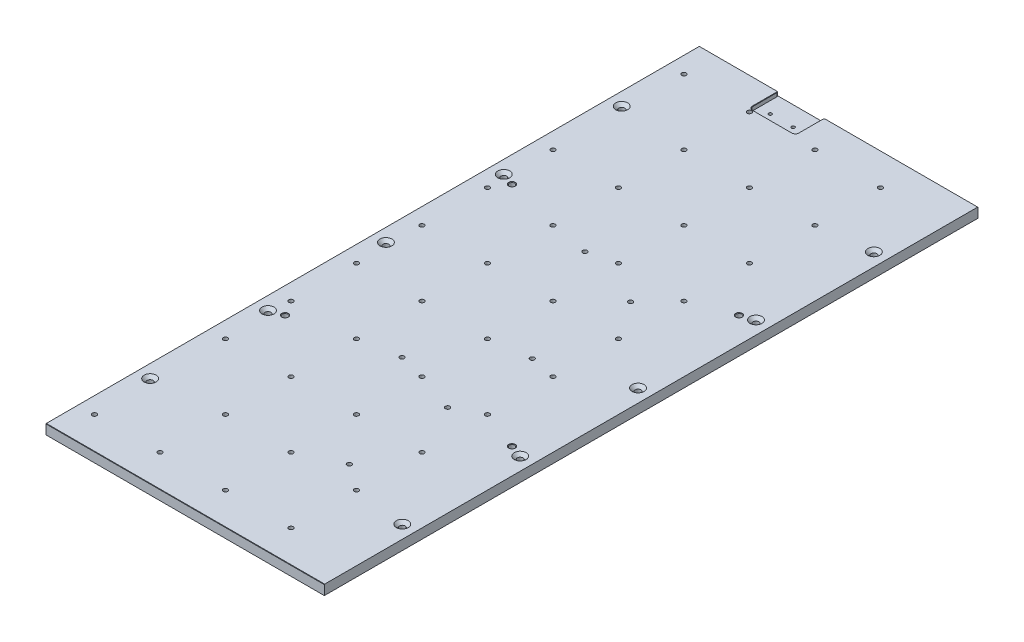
SolidWorks part; units mm, degrees
ref_plane "Ebene vorne" through (0, 0, 0) normal (0, 0, 1) x (1, 0, 0)
ref_plane "Ebene oben" through (0, 0, 0) normal (0, 1, 0) x (1, 0, 0)
ref_plane "Ebene rechts" through (0, 0, 0) normal (1, 0, 0) x (0, 0, -1)
sketch "Skizze1" plane through (0, 0, 0) normal (0, 1, 0) x (1, 0, 0)
  line L0 (-688, 499) -> (-748, 439)
  line L1 (-688, -499) -> (688, -499)
  line L2 (-688, -499) -> (-688, 499) construction
  line L3 (-688, 499) -> (688, 499)
  line L4 (688, -499) -> (688, 499) construction
  line L5 (-688, -499) -> (688, 499) construction
  line L6 (-688, 499) -> (688, -499) construction
  line L7 (-748, 439) -> (-748, -439)
  line L8 (-688, -499) -> (-748, -439)
  line L10 (688, -499) -> (748, -439)
  line L11 (748, -439) -> (748, 439)
  line L12 (748, 439) -> (688, 499)
  line L13 (-748, 0) -> (0, 0) construction
  point P0 (0, 0)
  dimension "D1" = 1496
  dimension "D2" = 998
  dimension "D3" = 60
  dimension "D4" = 45
extrude "Aufsatz-Linear austragen1" add sketch "Skizze1" along normal blind 15
hole_wizard "HORST900 Mitte Vorne_M8 Gewindebohrung1" positions "Skizze4" profile "Skizze5" tap size "M8" standard "DIN"
sketch "Skizze4" plane through (0, 15, 0) normal (0, 1, 0) x (1, 0, 0)
  line L0 (-688, -499) -> (688, -499) construction
  line L1 (0, -181.5) -> (-197.5, -181.5) construction
  line L2 (-197.5, -181.5) -> (0, 16) construction
  line L3 (0, 16) -> (197.5, -181.5) construction
  line L4 (197.5, -181.5) -> (0, -379) construction
  line L5 (0, -379) -> (-197.5, -181.5) construction
  line L7 (-139.6536, -321.1536) -> (139.6536, -41.8464) construction
  line L8 (-139.6536, -41.8464) -> (139.6536, -321.1536) construction
  circle A0 centre (0, -181.5) radius 197.5 construction
  point P21 (-139.6536, -321.1536)
  point P22 (139.6536, -41.8464)
  point P23 (-139.6536, -41.8464)
  point P24 (139.6536, -321.1536)
  dimension "D1" = 395
  dimension "D2" = 120
sketch "Skizze5" plane through (139.6536, 15, 321.1536) normal (1, 0, 0) x (0, 0, 1)
  line L0 (0, 0) -> (0, 15)
  line L1 (0, 15) -> (3.4, 15)
  line L2 (3.4, 15) -> (3.4, 0)
  line L5 (3.4, 0) -> (0, 0)
  line L11 (0, -6.35) -> (0, 107.95) construction
  dimension "Bohrerdurchmesser" = 6.8
  dimension "Bohrungstiefe" = 15
hole_wizard "HORST900_Links_Rechts_M8 Gewindebohrung1" positions "Skizze6" profile "Skizze7" tap size "M8" standard "DIN"
sketch "Skizze6" plane through (0, 15, 0) normal (0, 1, 0) x (1, 0, 0)
  line L1 (240.8464, -139.6536) -> (520.1536, -139.6536) construction
  line L2 (240.8464, -139.6536) -> (240.8464, 139.6536) construction
  line L3 (240.8464, 139.6536) -> (520.1536, 139.6536) construction
  line L4 (520.1536, -139.6536) -> (520.1536, 139.6536) construction
  line L5 (240.8464, -139.6536) -> (520.1536, 139.6536) construction
  line L6 (240.8464, 139.6536) -> (520.1536, -139.6536) construction
  line L7 (748, -439) -> (748, 439) construction
  circle A0 centre (380.5, 0) radius 197.5 construction
  point P5 (520.1536, 139.6536)
  point P8 (240.8464, -139.6536)
  point P9 (240.8464, 139.6536)
  point P10 (520.1536, -139.6536)
  dimension "D1" = 395
  dimension "D2" = 170
sketch "Skizze7" plane through (520.1536, 15, 139.6536) normal (1, 0, 0) x (0, 0, 1)
  line L0 (0, 0) -> (0, 15)
  line L1 (0, 15) -> (3.4, 15)
  line L2 (3.4, 15) -> (3.4, 0)
  line L5 (3.4, 0) -> (0, 0)
  line L11 (0, -6.35) -> (0, 107.95) construction
  dimension "Bohrerdurchmesser" = 6.8
  dimension "Bohrungstiefe" = 15
pattern_linear "HORST900_MitteM8 Gewindebohrung1" count 2 spacing 150 along (0, 0, -1) of "HORST900 Mitte Vorne_M8 Gewindebohrung1"
hole_wizard "Raster_M8 Gewindebohrung3" positions "Skizze9" profile "Skizze10" tap size "M8" standard "DIN"
sketch "Skizze9" plane through (0, 15, 0) normal (0, 1, 0) x (1, 0, 0)
  point P0 (-700, -450)
  dimension "D1" = 700
  dimension "D2" = 450
sketch "Skizze10" plane through (-700, 15, 450) normal (1, 0, 0) x (0, 0, 1)
  line L0 (0, 0) -> (0, 15)
  line L1 (0, 15) -> (3.4, 15)
  line L2 (3.4, 15) -> (3.4, 0)
  line L5 (3.4, 0) -> (0, 0)
  line L11 (0, -6.35) -> (0, 107.95) construction
  dimension "Bohrerdurchmesser" = 6.8
  dimension "Bohrungstiefe" = 15
hole_wizard "Formsenkung für M8 Senkschraube mit Innensechskant1" positions "Skizze2" profile "Skizze3" countersink size "M8" standard "DIN"
sketch "Skizze2" plane through (0, 15, 0) normal (0, 1, 0) x (1, 0, 0)
  line L1 (445, -360) -> (-445, -360)
  line L2 (445, -360) -> (445, 360)
  line L3 (445, 360) -> (-445, 360)
  line L4 (-445, -360) -> (-445, 360)
  line L5 (445, -360) -> (-445, 360) construction
  line L6 (445, 360) -> (-445, -360) construction
  line L7 (0, 0) -> (-610.081, 0) construction
  line L8 (-555, 210) -> (-555, -210) construction
  line L13 (0, 0) -> (0, -385.3386) construction
  line L18 (555, 210) -> (555, -210) construction
  line L19 (-20, 360) -> (-20, -360)
  line L21 (20, 360) -> (20, -360)
  line L22 (-555, 250) -> (-555, 210) construction
  line L24 (-555, -210) -> (-555, -250) construction
  line L26 (555, -210) -> (555, -250) construction
  line L28 (555, 210) -> (555, 250) construction
  line L29 (445, 0) -> (405, 0) construction
  point P2 (-445, 360)
  point P5 (445, -360)
  point P6 (445, 360)
  point P7 (-445, -360)
  point P98 (-555, 210)
  point P100 (-555, -210)
  point P123 (555, 210)
  point P125 (555, -210)
  point P139 (-20, 360)
  point P142 (20, 360)
  point P145 (-20, -360)
  point P148 (20, -360)
  point P150 (-20, 0)
  point P152 (20, 0)
  point P174 (-555, 250)
  point P177 (-555, -250)
  point P180 (555, -250)
  point P183 (555, 250)
  point P184 (-405, 360)
  point P186 (405, 360)
  point P188 (405, -360)
  point P190 (-405, -360)
  point P191 (-445, 0)
  point P193 (-405, 0)
  point P195 (445, 0)
  point P197 (405, 0)
  dimension "D1" = 890
  dimension "D2" = 720
  dimension "D3" = 40
  dimension "D4" = 1110
  dimension "D5" = 500
  dimension "D6" = 40
  dimension "D7" = 40
  dimension "D8" = 40
  dimension "D9" = 40
  dimension "D10" = 40
  dimension "D11" = 40
  dimension "D12" = 40
sketch "Skizze3" plane through (-445, 15, -360) normal (1, 0, 0) x (0, 0, 1)
  line L0 (0, 0) -> (0, 15)
  line L1 (0, 15) -> (4.5, 15)
  line L2 (4.5, 15) -> (4.5, 4.625)
  line L3 (4.5, 4.625) -> (9.125, 0)
  line L5 (9.125, 0) -> (0, 0)
  line L6 (-4.5, 4.625) -> (-9.125, 0) construction
  line L11 (0, -6.35) -> (0, 107.95) construction
  dimension "Bohrerdurchmesser" = 9
  dimension "Bohrungstiefe" = 15
  dimension "Senkdurchmesser (Oben)" = 18.25
  dimension "Senkwinkel (Oben)" = 90
sketch "Skizze8" plane through (0, 15, 0) normal (0, 1, 0) x (1, 0, 0)
  line L1 (100, 300) -> (200, 300)
  line L2 (95, 305) -> (95, 337)
  line L3 (100, 342) -> (200, 342)
  line L4 (205, 305) -> (205, 337)
  line L5 (95, 300) -> (205, 342) construction
  line L6 (95, 342) -> (205, 300) construction
  arc A0 (95, 305) -> (100, 300) centre (100, 305) ccw
  arc A1 (200, 300) -> (205, 305) centre (200, 305) ccw
  arc A2 (205, 337) -> (200, 342) centre (200, 337) ccw
  arc A3 (100, 342) -> (95, 337) centre (100, 337) ccw
  point P0 (150, 321)
  dimension "D5" = 5
  dimension "D1" = 150
  dimension "D2" = 110
  dimension "D3" = 42
  dimension "D4" = 321
extrude "Schnitt-Linear austragen1" cut sketch "Skizze8" against normal through all
hole_wizard "M5 Gewindebohrung1" positions "Skizze17" profile "Skizze18" tap size "M5" standard "DIN"
sketch "Skizze17" plane through (0, 15, 0) normal (0, 1, 0) x (1, 0, 0)
  line L0 (150, 342) -> (150, 300) construction
  line L1 (200, 342) -> (100, 342) construction
  line L2 (100, 300) -> (200, 300) construction
  line L3 (95, 321) -> (150, 321) construction
  line L4 (95, 337) -> (95, 305) construction
  line L5 (150, 321) -> (205, 321) construction
  line L6 (205, 305) -> (205, 337) construction
  point P17 (85, 337)
  point P19 (85, 305)
  point P21 (215, 305)
  point P23 (215, 337)
  dimension "D1" = 32
  dimension "D2" = 130
sketch "Skizze18" plane through (215, 15, -337) normal (1, 0, 0) x (0, 0, 1)
  line L0 (0, 0) -> (0, 13.2618)
  line L1 (0, 13.2618) -> (2.1, 12)
  line L2 (2.1, 12) -> (2.1, 0)
  line L5 (2.1, 0) -> (0, 0)
  line L10 (0, 13.2618) -> (-2.1, 12) construction
  line L11 (0, -6.35) -> (0, 107.95) construction
  dimension "Bohrerdurchmesser" = 4.2
  dimension "Bohrungstiefe" = 12
  dimension "Spitzenwinkel" = 118
sketch "Skizze11" plane through (0, 15, 0) normal (0, 1, 0) x (1, 0, 0)
  line L0 (0, 0) -> (0, 417.1845) construction
  line L1 (688, 499) -> (-688, 499) construction
  line L2 (-270, 455) -> (-270, 499) construction
  line L3 (-305.1, 499) -> (-234.9, 499)
  line L4 (-305.1, 499) -> (-305.1, 460)
  line L5 (-300.1, 455) -> (-239.9, 455)
  line L6 (-234.9, 499) -> (-234.9, 460)
  line L7 (234.9, 499) -> (234.9, 460)
  line L8 (300.1, 455) -> (239.9, 455)
  line L9 (305.1, 499) -> (305.1, 460)
  line L10 (305.1, 499) -> (234.9, 499)
  arc A0 (-234.9, 460) -> (-239.9, 455) centre (-239.9, 460) cw
  arc A1 (-300.1, 455) -> (-305.1, 460) centre (-300.1, 460) cw
  arc A2 (300.1, 455) -> (305.1, 460) centre (300.1, 460) ccw
  arc A3 (234.9, 460) -> (239.9, 455) centre (239.9, 460) ccw
  point P12 (-234.9, 455)
  point P15 (-305.1, 455)
  point P25 (305.1, 455)
  point P26 (234.9, 455)
  dimension "D3" = 5
  dimension "D1" = 44
  dimension "D2" = 70.2
  dimension "D4" = 270
extrude "Schnitt-Linear austragen2" cut sketch "Skizze11" against normal blind 6
fillet "Verrundung2" radius 2 4 edges at (-234.9, 12, -499) (-305.1, 12, -499) (305.1, 12, -499) (234.9, 12, -499)
hole_wizard "M6 Gewindebohrung1" positions "Skizze12" profile "Skizze13" tap size "M6" standard "DIN"
sketch "Skizze12" plane through (0, 9, 0) normal (0, 1, 0) x (1, 0, 0)
  line L0 (-270, 95.0617) -> (-270, 469.2) construction
  line L1 (-270, 469.2) -> (-287.5, 469.2) construction
  line L3 (-270, 469.2) -> (-252.5, 469.2) construction
  line L6 (-300.1, 455) -> (-239.9, 455) construction
  line L7 (-270, 469.2) -> (-270, 499) construction
  line L8 (-232.9, 499) -> (-307.1, 499) construction
  point P0 (-287.5, 469.2)
  point P4 (-252.5, 469.2)
  dimension "D1" = 35
  dimension "D2" = 14.2
sketch "Skizze13" plane through (-287.5, 9, -469.2) normal (1, 0, 0) x (0, 0, 1)
  line L0 (0, 0) -> (0, 9)
  line L1 (0, 9) -> (2.5, 9)
  line L2 (2.5, 9) -> (2.5, 0)
  line L5 (2.5, 0) -> (0, 0)
  line L11 (0, -6.35) -> (0, 107.95) construction
  dimension "Bohrerdurchmesser" = 5
  dimension "Bohrungstiefe" = 9
mirror "Spiegeln3" about plane through (0, 0, 0) normal (1, 0, 0) of "HORST900_Links_Rechts_M8 Gewindebohrung1"
mirror "Spiegeln2" about plane through (0, 0, 0) normal (1, 0, 0) of "M6 Gewindebohrung1"
pattern_linear "Raster_M8 Gewindebohrung4" count 15 spacing 100 along (1, 0, 0) count 10 spacing 100 along (0, 0, -1) of "Raster_M8 Gewindebohrung3"
hole_wizard "Ø5.0mm Stiftloch1" positions "Skizze14" profile "Skizze15" hole size "Ø5.0" standard "DIN"
sketch "Skizze14" plane through (0, 15, 0) normal (0, 1, 0) x (1, 0, 0)
  line L1 (-500, -225) -> (500, -225)
  line L2 (-500, -225) -> (-500, 225)
  line L3 (-500, 225) -> (500, 225)
  line L4 (500, -225) -> (500, 225)
  line L5 (-500, -225) -> (500, 225) construction
  line L6 (-500, 225) -> (500, -225) construction
  point P2 (500, 225)
  point P5 (-500, -225)
  point P6 (-500, 225)
  point P7 (500, -225)
  dimension "D1" = 1000
  dimension "D2" = 450
sketch "Skizze15" plane through (500, 15, -225) normal (1, 0, 0) x (0, 0, 1)
  line L0 (0, 0) -> (0, 9.5022)
  line L1 (0, 9.5022) -> (2.5, 8)
  line L2 (2.5, 8) -> (2.5, 0)
  line L5 (2.5, 0) -> (0, 0)
  line L10 (0, 9.5022) -> (-2.5, 8) construction
  line L11 (0, -6.35) -> (0, 107.95) construction
  dimension "Bohrerdurchmesser" = 5
  dimension "Bohrungstiefe" = 8
  dimension "Spitzenwinkel" = 118
sketch "Skizze19" plane through (0, 15, 0) normal (0, 1, 0) x (1, 0, 0)
  line L0 (-748, -335.3333) -> (-584.3333, -499)
  line L1 (-748, 439) -> (-748, -439) construction
  line L2 (-688, -499) -> (688, -499) construction
  line L3 (-700, -450) -> (-666.6667, -416.6667) construction
  line L4 (-666.6667, -416.6667) -> (-633.3333, -383.3333) construction
  line L5 (-633.3333, -383.3333) -> (-600, -350) construction
  line L7 (-748, -335.3333) -> (-748, -499)
  line L8 (-748, -499) -> (-584.3333, -499)
  line L9 (0, 0) -> (-867.3636, 0) construction
  line L10 (0, 0) -> (0, 198.8508) construction
  line L11 (748, 335.3333) -> (584.3333, 499)
  line L12 (748, 335.3333) -> (748, 499)
  line L13 (748, 499) -> (584.3333, 499)
  line L14 (748, -499) -> (584.3333, -499)
  line L15 (-748, 499) -> (-584.3333, 499)
  line L16 (-748, 335.3333) -> (-748, 499)
  line L17 (-748, 335.3333) -> (-584.3333, 499)
  line L18 (748, -335.3333) -> (748, -499)
  line L19 (748, -335.3333) -> (584.3333, -499)
extrude "Schnitt-Linear austragen4" cut sketch "Skizze19" against normal through all
fillet "Verrundung1" radius 10 8 edges at (-584.3333, 7.5, 499) (584.3333, 7.5, 499) (748, 7.5, 335.3333) (748, 7.5, -335.3333) (584.3333, 7.5, -499) (-584.3333, 7.5, -499) (-748, 7.5, -335.3333) (-748, 7.5, 335.3333)
chamfer "Fase1" distance 0.5 angle 45 40 edges at (0, 15, -499) (-234.3142, 15, -498.4142) (234.3142, 15, -498.4142) (-234.9, 15, -478.5) (234.9, 15, -478.5) (-236.3645, 15, -456.4645) (236.3645, 15, -456.4645) (-270, 15, -455) (270, 15, -455) (-303.6355, 15, -456.4645) (303.6355, 15, -456.4645) (-305.1, 15, -478.5) (305.1, 15, -478.5) (-305.6858, 15, -498.4142) (305.6858, 15, -498.4142) (-443.6456, 15, -499) (443.6456, 15, -499) (-748, 15, 0) (748, 15, 0) (0, 15, 499) (150, 15, -300) (203.5355, 15, -301.4645) (96.4645, 15, -301.4645) (205, 15, -321) (95, 15, -321) (203.5355, 15, -340.5355) (96.4645, 15, -340.5355) (150, 15, -342) (-666.1667, 15, 417.1667) (-584.018, 15, 498.2388) (-584.018, 15, -498.2388) (584.018, 15, -498.2388) (-666.1667, 15, -417.1667) (666.1667, 15, -417.1667) (-747.2388, 15, -335.018) (747.2388, 15, -335.018) (-747.2388, 15, 335.018) (747.2388, 15, 335.018) (666.1667, 15, 417.1667) (584.018, 15, 498.2388)
ref_plane "Ebene1" through (425, 0, 0) normal (1, 0, 0) x (0, 0, -1)
ref_plane "Ebene2" through (-425, 0, 0) normal (1, 0, 0) x (0, 0, -1)
split "Abspalten1" [suppressed] bodies to split 128
split "Abspalten2" trim tools "Ebene1", "Ebene2", "Ebene rechts" bodies to split 128 resulting bodies 135
split "Abspalten3" [suppressed] bodies to split 138
hole_wizard "HORST1400 M10 Gewindebohrung1" positions "Skizze20" profile "Skizze21" tap size "M10" standard "DIN"
sketch "Skizze20" plane through (0, 15, 0) normal (0, 1, 0) x (1, 0, 0)
  line L1 (-385.7412, 173.2412) -> (-39.2588, 173.2412) construction
  line L2 (-385.7412, 173.2412) -> (-385.7412, -173.2412) construction
  line L3 (-385.7412, -173.2412) -> (-39.2588, -173.2412) construction
  line L4 (-39.2588, 173.2412) -> (-39.2588, -173.2412) construction
  line L6 (0, -498.5) -> (0, 498.5) construction
  line L7 (-212.5, 0) -> (-110.9328, 0) construction
  circle A0 centre (-212.5, 0) radius 245 construction
  point P0 (-39.2588, -173.2412)
  point P7 (-385.7412, 173.2412)
  point P137 (-385.7412, -173.2412)
  point P138 (-39.2588, 173.2412)
  dimension "D1" = 490
  dimension "D2" = 212.5
sketch "Skizze21" plane through (-39.2588, 15, 173.2412) normal (1, 0, 0) x (0, 0, 1)
  line L0 (0, 0) -> (0, 30.0537)
  line L1 (0, 30.0537) -> (4.25, 27.5)
  line L2 (4.25, 27.5) -> (4.25, 0.775)
  line L3 (4.25, 0.775) -> (5.025, 0)
  line L5 (5.025, 0) -> (0, 0)
  line L6 (-4.25, 0.775) -> (-5.025, 0) construction
  line L10 (0, 30.0537) -> (-4.25, 27.5) construction
  line L11 (0, -6.35) -> (0, 107.95) construction
  dimension "Bohrerdurchmesser" = 8.5
  dimension "Bohrungstiefe" = 27.5
  dimension "Senkdurchmesser (Oben)" = 10.05
  dimension "Senkwinkel (Oben)" = 90
  dimension "Spitzenwinkel" = 118
hole_wizard "Formsenkung für M8 Senkschraube mit Innensechskant2" positions "Skizze24" profile "Skizze25" countersink size "M8" standard "DIN"
sketch "Skizze24" plane through (0, 15, 0) normal (0, 1, 0) x (1, 0, 0)
  line L0 (-405, -180) -> (-20, -180) construction
  line L1 (-20, -180) -> (-20, 0) construction
  line L3 (-20, -180) -> (-20, -360) construction
  line L5 (-405, 0) -> (-405, -360) construction
  line L7 (-405, 0) -> (-20, 0) construction
  point P0 (-405, -180)
  point P2 (-20, -180)
  point P35 (-20, 180)
  point P36 (-405, 180)
sketch "Skizze25" plane through (-405, 15, 180) normal (1, 0, 0) x (0, 0, 1)
  line L0 (0, 0) -> (0, 15)
  line L1 (0, 15) -> (4.5, 15)
  line L2 (4.5, 15) -> (4.5, 4.625)
  line L3 (4.5, 4.625) -> (9.125, 0)
  line L5 (9.125, 0) -> (0, 0)
  line L6 (-4.5, 4.625) -> (-9.125, 0) construction
  line L11 (0, -6.35) -> (0, 107.95) construction
  dimension "Bohrerdurchmesser" = 9
  dimension "Bohrungstiefe" = 15
  dimension "Senkdurchmesser (Oben)" = 18.25
  dimension "Senkwinkel (Oben)" = 90
